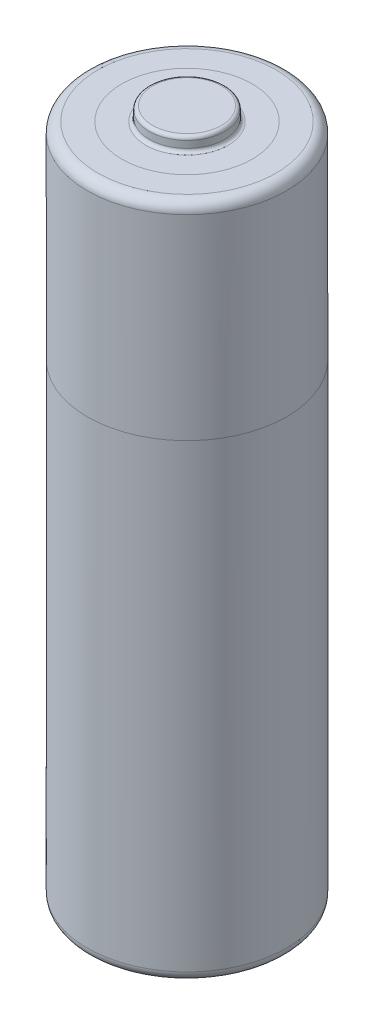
SolidWorks part; units mm, degrees
ref_plane "Front Plane" through (0, 0, 0) normal (0, 0, 1) x (1, 0, 0)
ref_plane "Top Plane" through (0, 0, 0) normal (0, 1, 0) x (1, 0, 0)
ref_plane "Right Plane" through (0, 0, 0) normal (1, 0, 0) x (0, 0, -1)
sketch "Sketch1" plane through (0, 0, 0) normal (0, 0, 1) x (1, 0, 0)
  line L0 (0, 0) -> (0, -53.4264) construction
  line L1 (0, 0) -> (-7.25, 0)
  line L2 (-7.25, 0) -> (-7.25, -49.5)
  line L4 (0, -49.5) -> (0, 0)
  line L5 (0, -49.5) -> (-7.25, -49.5)
  dimension "ODMax" = 14.5
  dimension "A" = 49.5
revolve "Revolve1" add sketch "Sketch1" angle 360 about L0
sketch "Sketch2" plane through (0, 0, 0) normal (0, 0, 1) x (1, 0, 0)
  line L0 (0, 0) -> (0, 11.638) construction
  line L1 (7.25, 0) -> (-7.25, 0) construction
  line L2 (0, 1) -> (-2.75, 1)
  line L3 (-2.75, 1) -> (-2.75, 0)
  line L4 (-2.75, 0) -> (0, 0)
  line L5 (0, 0) -> (0, 1)
  dimension "F" = 5.5
  dimension "G" = 1
revolve "Revolve2" add sketch "Sketch2" angle 360 about L0
sketch "Sketch4" plane through (0, 0, 0) normal (0, 0, 1) x (1, 0, 0)
  line L0 (0, 0) -> (0, -57.9549) construction
  line L1 (3.5, -49.5) -> (3.6443, -49.25)
  line L2 (-7.25, -49.5) -> (7.25, -49.5) construction
  line L3 (3.6443, -49.25) -> (7.25, -49.25)
  line L4 (7.25, -49.5) -> (7.25, 0) construction
  line L5 (7.25, -49.25) -> (7.25, -49.5)
  line L6 (7.25, -49.5) -> (3.5, -49.5)
  dimension "D1" = 0.25
  dimension "D2" = 7
  dimension "D3" = 60
revolve "Cut-Revolve2" cut sketch "Sketch4" angle 360 about L0
sketch "Sketch3" plane through (0, 0, 0) normal (0, 0, 1) x (1, 0, 0)
  line L0 (0, 0) -> (0, -66.1181) construction
  line L1 (-7.25, -49.5) -> (7.25, -49.5) construction
  line L2 (6.5, -49.5) -> (0, -49.5)
  line L3 (6.5, -49.5) -> (6.5, -48.6)
  line L4 (6.5, -48.6) -> (0, -48.6)
  line L5 (0, -49.5) -> (0, -48.6)
  dimension "D1" = 13
  dimension "D2" = 0.9
revolve "Cut-Revolve1" [suppressed] cut sketch "Sketch3" angle 360 about L0
sketch "Sketch5" plane through (0, 0, 0) normal (0, 1, 0) x (1, 0, 0)
  circle A0 centre (0, 0) radius 4.75
  circle A2 centre (0, 0) radius 7.25 construction
  dimension "D1" = 2.5
sketch "Sketch6" plane through (0, -49.25, 0) normal (0, -1, 0) x (1, 0, 0)
  circle A0 centre (0, 0) radius 4.75
  circle A2 centre (0, 0) radius 7.25 construction
  dimension "D1" = 2.5
sketch "Sketch7" plane through (0, 0, 0) normal (0, 0, 1) x (1, 0, 0)
  line L0 (-7.25, -15) -> (7.25, -15)
  line L1 (0, 0) -> (0, -15) construction
  line L2 (7.25, -49.25) -> (7.25, 0) construction
  dimension "D1" = 15
fillet "Fillet1" radius 0.75 2 edges at (0, -49.25, 7.25) (0, 0, 7.25)
fillet "Fillet2" radius 0.25 4 edges at (0, 1, -2.75) (0, 0, -2.75) (0, -49.5, 3.5) (0, -49.25, 3.6443)
fillet "Fillet3" [suppressed] radius 0.25
fillet "Fillet4" [suppressed] radius 0.75
